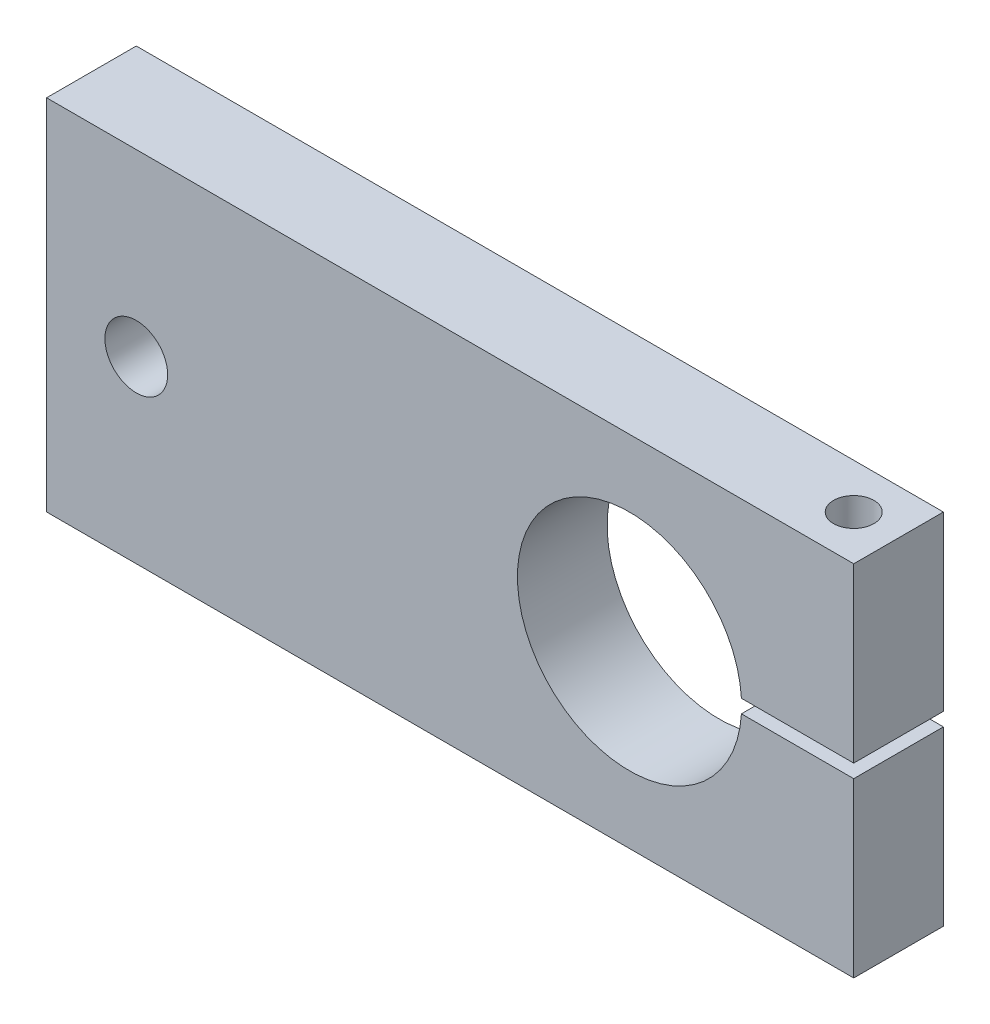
SolidWorks part; units mm, degrees
ref_plane "前视基准面" through (0, 0, 0) normal (0, 0, 1) x (1, 0, 0)
ref_plane "上视基准面" through (0, 0, 0) normal (0, 1, 0) x (1, 0, 0)
ref_plane "右视基准面" through (0, 0, 0) normal (1, 0, 0) x (0, 0, -1)
sketch "草图1" plane through (0, 0, 0) normal (0, 0, 1) x (1, 0, 0)
  line L0 (0, 0) -> (-110, 0) construction
  line L1 (-110, 0) -> (-130, 0) construction
  line L2 (-130, 40) -> (-130, -40)
  line L3 (-130, -40) -> (50, -40)
  line L4 (50, -40) -> (50, -1.5)
  line L5 (50, 40) -> (-130, 40)
  line L6 (50, 1.5) -> (50, 40)
  line L7 (24.955, 1.5) -> (50, 1.5)
  line L9 (24.955, -1.5) -> (50, -1.5)
  line L11 (-8.9109, 1.5) -> (58.9109, -1.5) construction
  line L12 (25, 0) -> (58.9109, 1.5) construction
  arc A0 (24.955, 1.5) -> (24.955, -1.5) centre (0, 0) ccw
  circle A1 centre (-110, 0) radius 7
  point P10 (25, 0)
  dimension "D1" = 110
  dimension "D2" = 20
  dimension "D3" = 3
extrude "凸台-拉伸2" add sketch "草图1" along normal blind 20
sketch "草图2" plane through (0, -40, 0) normal (0, -1, 0) x (1, 0, 0)
  line L0 (50, 10) -> (40, 10) construction
  line L1 (50, 20) -> (50, 0) construction
  circle A0 centre (40, 10) radius 7
extrude "切除-拉伸1" cut sketch "草图2" against normal blind 10
sketch "草图3" plane through (0, -30, 0) normal (0, -1, 0) x (1, 0, 0)
  circle A0 centre (40, 10) radius 4.5
extrude "切除-拉伸2" cut sketch "草图3" against normal blind 78
